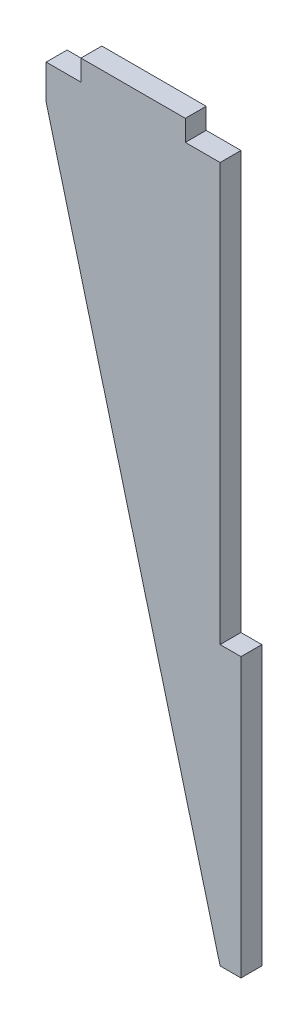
SolidWorks part; units mm, degrees
ref_plane "Plan de face" through (0, 0, 0) normal (0, 0, 1) x (1, 0, 0)
ref_plane "Plan de dessus" through (0, 0, 0) normal (0, 1, 0) x (1, 0, 0)
ref_plane "Plan de droite" through (0, 0, 0) normal (1, 0, 0) x (0, 0, -1)
sketch "Esquisse1" plane through (0, 0, 0) normal (0, 0, 1) x (1, 0, 0)
  line L1 (-67, -100) -> (-70, -100) construction
  line L2 (-67, -60) -> (-67, -100) construction
  line L3 (-67, -60) -> (-70, -60) construction
  line L4 (-67, -100) -> (-70, -100)
  line L5 (-67, -60) -> (-67, -100)
  line L6 (-67, -60) -> (-70, -60)
  line L7 (-70, -60) -> (-70, 0)
  line L8 (-70, 0) -> (-75, 0)
  line L9 (-75, 0) -> (-75, 3)
  line L10 (-75, 3) -> (-90, 3)
  line L11 (-90, 3) -> (-90, 0)
  line L12 (-90, 0) -> (-95, 0)
  line L13 (-95, 0) -> (-95, -5)
  line L14 (-95, -5) -> (-70, -100)
  line L16 (100, 3) -> (-100, 3) construction
  dimension "D3" = 15
  dimension "D4" = 5
  dimension "D5" = 5
  dimension "D6" = 5
extrude "Boss.-Extru.1" add sketch "Esquisse1" along normal up to surface (3 mm away)
